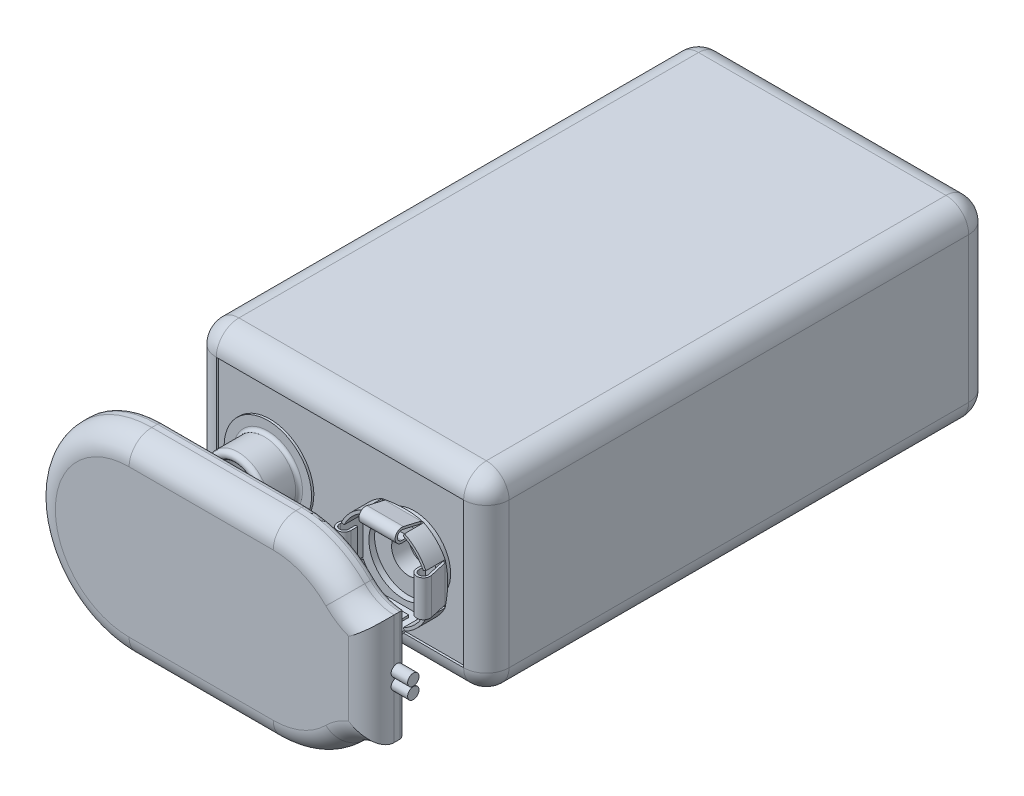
SolidWorks part; units mm, degrees
ref_plane "Front Plane" through (0, 0, 0) normal (0, 0, 1) x (1, 0, 0)
ref_plane "Top Plane" through (0, 0, 0) normal (0, 1, 0) x (1, 0, 0)
ref_plane "Right Plane" through (0, 0, 0) normal (1, 0, 0) x (0, 0, -1)
imported_body "9V-1-solid1"
imported_body "PP3BatteryClip-1-solid1"
scale "Scale2" bodies to scale 104 103 scale about centroid uniform scaling yes scale factor 0.8
sketch "Sketch1" plane through (0, 0, 35.4179) normal (0, 0, 1) x (1, 0, 0)
  line L1 (21.3312, 16.9661) -> (24.0387, 16.9661)
  line L2 (21.3312, 16.9661) -> (21.3312, 13.0189)
  line L3 (21.3312, 13.0189) -> (24.0387, 13.0189)
  line L4 (24.0387, 16.9661) -> (24.0387, 13.0189)
extrude "Extrude1" cut sketch "Sketch1" against normal blind 10
